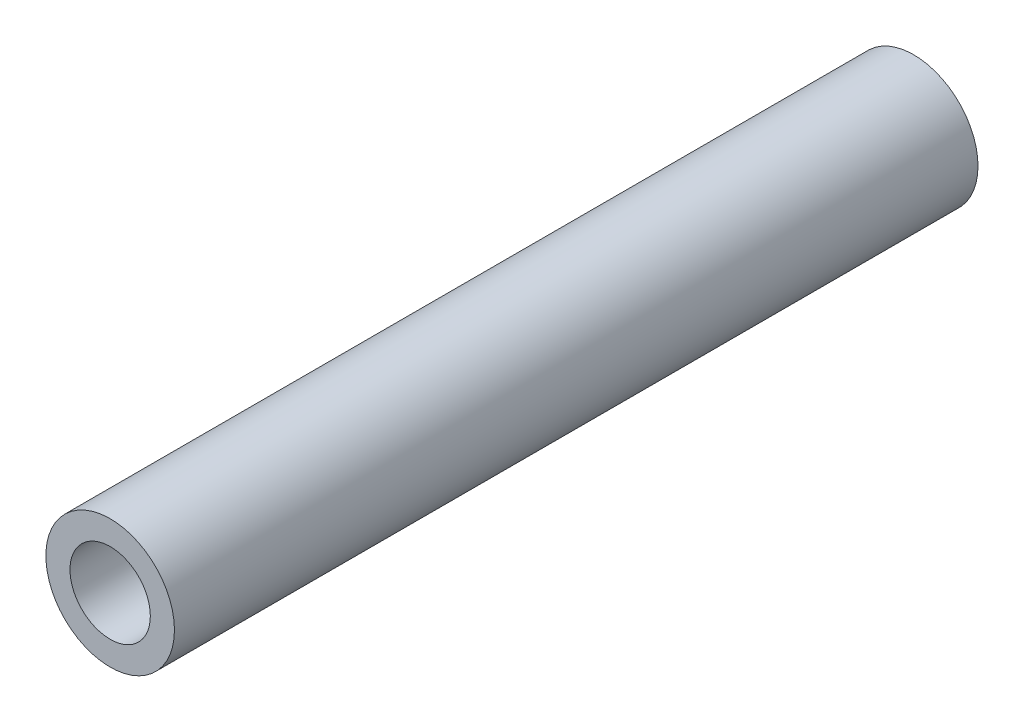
SolidWorks part; units mm, degrees
ref_plane "Face" through (0, 0, 0) normal (0, 0, 1) x (1, 0, 0)
ref_plane "Dessus" through (0, 0, 0) normal (0, 1, 0) x (1, 0, 0)
ref_plane "Droite" through (0, 0, 0) normal (1, 0, 0) x (0, 0, -1)
sketch "Esquisse1" plane through (0, 0, 0) normal (0, 0, 1) x (1, 0, 0)
  arc A2 (-10, 0) -> (-20, 0) centre (-15, 0) ccw
  arc A3 (-20, 0) -> (-10, 0) centre (-15, 0) ccw
  circle A4 centre (-15, 0) radius 8
  dimension "D1" = 16
  dimension "D2" = 5
  dimension "D3" = 15
extrude "Base-Extrusion" add sketch "Esquisse1" along normal blind 100
